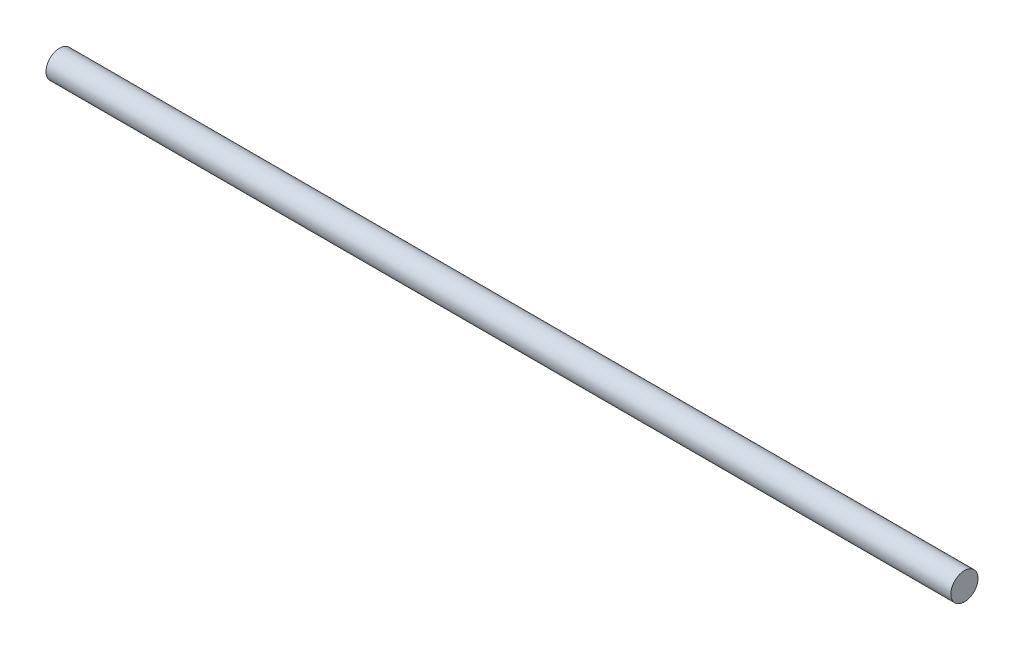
SolidWorks part; units mm, degrees
ref_plane "Front Plane" through (0, 0, 0) normal (0, 0, 1) x (1, 0, 0)
ref_plane "Top Plane" through (0, 0, 0) normal (0, 1, 0) x (1, 0, 0)
ref_plane "Right Plane" through (0, 0, 0) normal (1, 0, 0) x (0, 0, -1)
sketch "Sketch1" plane through (0, 0, 0) normal (1, 0, 0) x (0, 0, -1)
  circle A0 centre (0, 0) radius 1.5
  dimension "D1" = 3
extrude "Boss-Extrude1" add sketch "Sketch1" along normal blind 100
